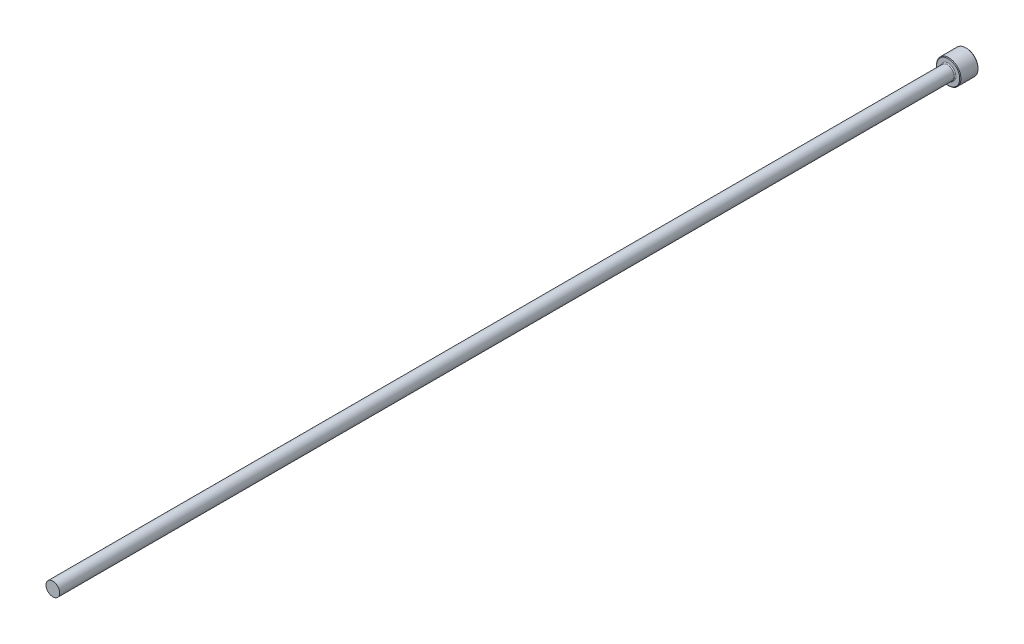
SolidWorks part; units mm, degrees
ref_plane "Front Plane" through (0, 0, 0) normal (0, 0, 1) x (1, 0, 0)
ref_plane "Top Plane" through (0, 0, 0) normal (0, 1, 0) x (1, 0, 0)
ref_plane "Right Plane" through (0, 0, 0) normal (1, 0, 0) x (0, 0, -1)
sketch "Sketch1" plane through (0, 0, 0) normal (1, 0, 0) x (0, 0, -1)
  line L0 (0, 0) -> (0, 4)
  line L1 (0, 4.4) -> (0, -4.4) construction
  line L2 (0, 4) -> (-6, 4)
  line L3 (-6, 4) -> (-6, 2.55)
  line L4 (-6.3, 2.25) -> (-300, 2.25)
  line L5 (-300, 2.25) -> (-300, 0)
  line L6 (4.4, 0) -> (-4.4, 0) construction
  line L7 (-300, 0) -> (0, 0)
  line L8 (-109.0506, 0) -> (16.9928, 0) construction
  arc A0 (-6, 2.55) -> (-6.3, 2.25) centre (-6.3, 2.55) cw
  dimension "D1" = 0.3
  dimension "D2" = 8
  dimension "D3" = 4.5
  dimension "D4" = 300
  dimension "D5" = 6
revolve "Revolve1" add sketch "Sketch1" angle 360 about L8
chamfer "Chamfer1" distance 0.2 angle 45 2 edges at (4, 0, 0) (4, 0, 6)
